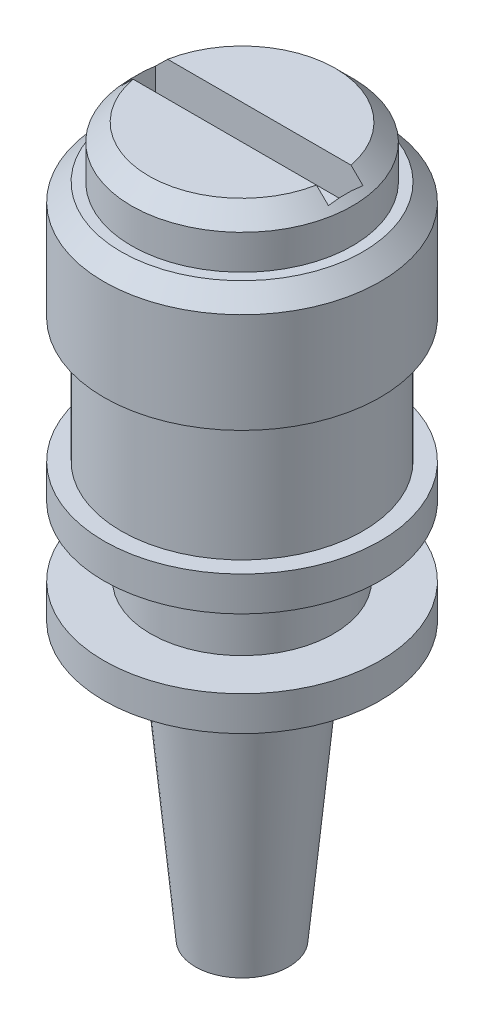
SolidWorks part; units mm, degrees
ref_plane "Plan1" through (0, 0, 0) normal (0, 0, 1) x (1, 0, 0)
ref_plane "Plan2" through (0, 0, 0) normal (0, 1, 0) x (1, 0, 0)
ref_plane "Plan3" through (0, 0, 0) normal (1, 0, 0) x (0, 0, -1)
sketch "Esquisse1" plane through (0, 0, 0) normal (0, 0, 1) x (1, 0, 0)
  line L0 (0, 80) -> (0, -63) construction
  line L1 (0, 0) -> (-1.35, 0)
  line L2 (-1.35, 0) -> (-2, 7)
  line L3 (-2, 7) -> (-2, 8)
  line L4 (-2, 8) -> (-4, 8)
  line L5 (-4, 8) -> (-4, 9)
  line L6 (-4, 9) -> (-2.65, 9)
  line L7 (-2.65, 9) -> (-2.65, 11)
  line L8 (-2.65, 11) -> (-4, 11)
  line L9 (-4, 11) -> (-4, 12)
  line L10 (-4, 12) -> (-3.5, 12)
  line L11 (-3.5, 12) -> (-3.5, 15.6)
  line L12 (-3.5, 15.6) -> (-4, 15.6)
  line L13 (-4, 15.6) -> (-4, 19)
  line L14 (-4, 19) -> (-3.2, 19)
  line L15 (-3.2, 19) -> (-3.2, 20.5)
  line L16 (-3.2, 20.5) -> (0, 20.5)
  line L17 (0, 20.5) -> (0, 0)
  dimension "D1" = 2.7
  dimension "D2" = 4
  dimension "D3" = 8
  dimension "D4" = 5.3
  dimension "D6" = 7
  dimension "D7" = 8
  dimension "D8" = 6.4
  dimension "D9" = 7
  dimension "D10" = 1
  dimension "D11" = 1
  dimension "D12" = 2
  dimension "D13" = 3.6
  dimension "D14" = 3.4
  dimension "D15" = 1.5
revolve "Base-Révolution" add sketch "Esquisse1" angle 360 about L0
chamfer "Chanfrein1" distance 0.5 angle 45
sketch "Esquisse2" plane through (0, 20.5, 0) normal (0, 1, 0) x (-1, 0, 0)
  line L0 (-4, 0) -> (5, 0) construction
  line L1 (0, -4) -> (0, 4) construction
  line L3 (-3, -0.5) -> (3, -0.5)
  line L4 (-3, -0.5) -> (-3, 0.5)
  line L5 (-3, 0.5) -> (3, 0.5)
  line L6 (3, -0.5) -> (3, 0.5)
  dimension "D1" = 6
  dimension "D2" = 1
extrude "Enlèv. mat.-Extru.1" cut sketch "Esquisse2" against normal blind 1
